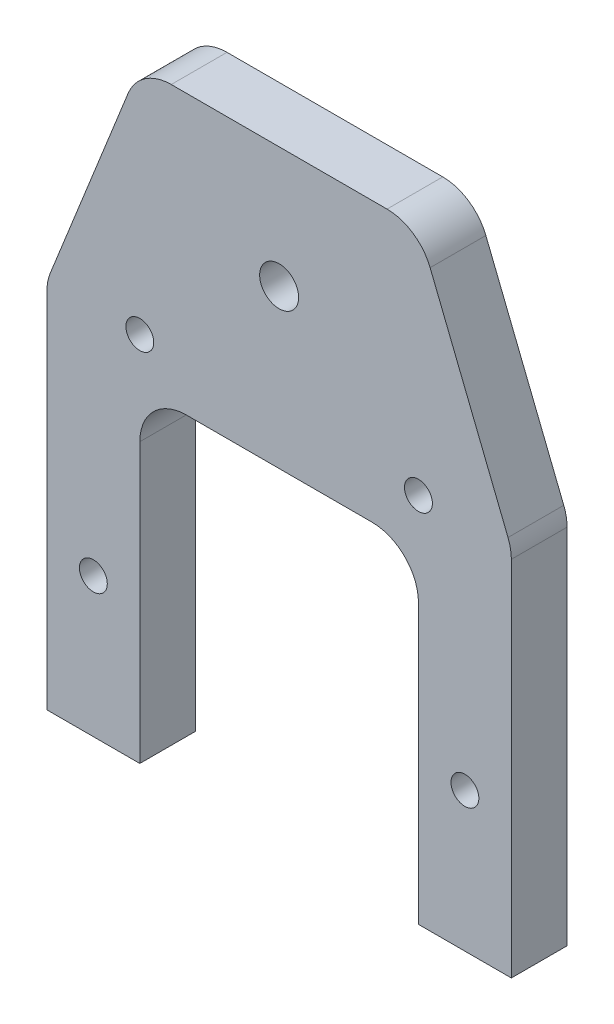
SolidWorks part; units mm, degrees
ref_plane "Plan de face" through (0, 0, 0) normal (0, 0, 1) x (1, 0, 0)
ref_plane "Plan de dessus" through (0, 0, 0) normal (0, 1, 0) x (1, 0, 0)
ref_plane "Plan de droite" through (0, 0, 0) normal (1, 0, 0) x (0, 0, -1)
sketch "Esquisse1" plane through (0, 0, 0) normal (0, 0, 1) x (1, 0, 0)
  line L0 (0, -9.4359) -> (0, 54.0267) construction
  line L1 (-9.1019, 0) -> (56.0307, 0) construction
  line L2 (50, -8.0998) -> (50, 54.0267) construction
  line L3 (10, -9.4359) -> (10, 70) construction
  line L4 (40, -8.0998) -> (40, 70) construction
  line L5 (6.2628, 35) -> (43.6722, 35) construction
  line L6 (-6.9308, 40) -> (53.3586, 40) construction
  line L7 (-3.4236, 65) -> (59.8719, 65) construction
  line L8 (0, 0) -> (0, 39.0371)
  line L9 (0.3576, 40.894) -> (8.7428, 61.857)
  line L10 (13.3852, 65) -> (36.6148, 65)
  line L11 (41.2572, 61.857) -> (49.6424, 40.894)
  line L12 (50, 39.0371) -> (50, 0)
  line L13 (50, 0) -> (0, 0)
  line L14 (25, -4.2587) -> (25, 70) construction
  line L15 (-5.5556, 15) -> (51.4147, 15) construction
  line L16 (45, 18.3834) -> (45, 11.0367) construction
  line L17 (5, 18.3834) -> (5, 11.0367) construction
  line L18 (19.7963, 52) -> (30.6725, 52) construction
  line L19 (13.3852, 45) -> (35.239, 45) construction
  arc A0 (0, 39.0371) -> (0.3576, 40.894) centre (5, 39.0371) cw
  arc A1 (49.6424, 40.894) -> (50, 39.0371) centre (45, 39.0371) cw
  arc A2 (36.6148, 65) -> (41.2572, 61.857) centre (36.6148, 60) cw
  arc A3 (8.7428, 61.857) -> (13.3852, 65) centre (13.3852, 60) cw
  circle A4 centre (10, 40) radius 1.5
  circle A5 centre (40, 40) radius 1.5
  circle A6 centre (5, 15) radius 1.5
  circle A7 centre (45, 15) radius 1.5
  circle A8 centre (25, 52) radius 2.1
  point P25 (0, 40)
  point P26 (0, 40)
  point P28 (10, 65)
  point P30 (50, 40)
  point P31 (40, 65)
  point P34 (50, 40)
  point P51 (40, 65)
  point P54 (10, 65)
  dimension "D1" = 5
extrude "Extrusion1" add sketch "Esquisse1" along normal blind 6
sketch "Esquisse5" plane through (0, 0, 6) normal (0, 0, 1) x (1, 0, 0)
  line L0 (10, -1.5862) -> (10, 36) construction
  line L1 (40, -1.5862) -> (40, 31.8078) construction
  line L2 (-3.4851, 35) -> (52.884, 35) construction
  line L3 (0, 0) -> (50, 0) construction
  line L4 (15, 35) -> (35, 35)
  line L5 (10, 30) -> (10, 0)
  line L6 (10, 0) -> (40, 0)
  line L7 (40, 30) -> (40, 0)
  arc A0 (35, 35) -> (40, 30) centre (35, 30) cw
  arc A1 (15, 35) -> (10, 30) centre (15, 30) ccw
  point P16 (10, 35)
  dimension "D1" = 5
extrude "Enlèv. mat.-Extru.3" cut sketch "Esquisse5" against normal blind 10
